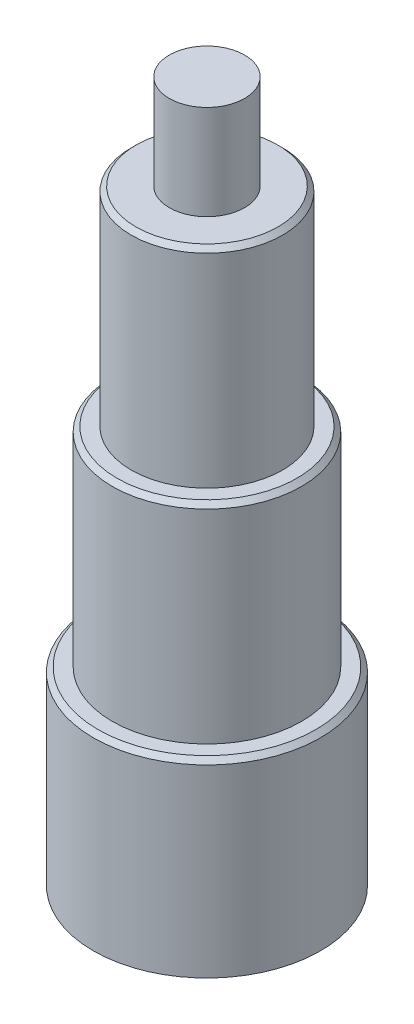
SolidWorks part; units mm, degrees
ref_plane "Front Plane" through (0, 0, 0) normal (0, 0, 1) x (1, 0, 0)
ref_plane "Top Plane" through (0, 0, 0) normal (0, 1, 0) x (1, 0, 0)
ref_plane "Right Plane" through (0, 0, 0) normal (1, 0, 0) x (0, 0, -1)
sketch "Sketch1" plane through (0, 0, 0) normal (0, 1, 0) x (1, 0, 0)
  circle A0 centre (0, 0) radius 6
  dimension "D1" = 12
extrude "Boss-Extrude1" add sketch "Sketch1" along normal blind 10
sketch "Sketch2" plane through (0, 10, 0) normal (0, 1, 0) x (1, 0, 0)
  circle A0 centre (0, 0) radius 5
  dimension "D1" = 10
extrude "Boss-Extrude2" add sketch "Sketch2" along normal blind 11
sketch "Sketch3" plane through (0, 21, 0) normal (0, 1, 0) x (1, 0, 0)
  circle A0 centre (0, 0) radius 4
  dimension "D1" = 8
extrude "Boss-Extrude3" add sketch "Sketch3" along normal blind 11
sketch "Sketch4" plane through (0, 32, 0) normal (0, 1, 0) x (1, 0, 0)
  circle A0 centre (0, 0) radius 1.989
  dimension "D1" = 3.978
extrude "Boss-Extrude4" add sketch "Sketch4" along normal blind 5
chamfer "Chamfer1" distance 0.25 angle 45 3 edges at (0, 32, 4) (0, 21, 5) (0, 10, 6)
hole_wizard "M4x0.7 Tapped Hole1" positions "Sketch6" profile "Sketch5" tap size "M4x0.7" standard "ANSI Metric"
sketch "Sketch6" plane through (0, 0, 0) normal (0, -1, 0) x (-1, 0, 0)
  point P0 (0, 0)
sketch "Sketch5" plane through (0, 0, 0) normal (1, 0, 0) x (0, 0, -1)
  line L0 (0, 0) -> (0, 15.0914)
  line L1 (0, 15.0914) -> (1.65, 14.1)
  line L2 (1.65, 14.1) -> (1.65, 0)
  line L5 (1.65, 0) -> (0, 0)
  line L10 (0, 15.0914) -> (-1.65, 14.1) construction
  line L11 (0, -6.35) -> (0, 107.95) construction
  dimension "Tap Drill Dia." = 3.3
  dimension "Tap Drill Depth" = 14.1
  dimension "Drill Angle" = 118
